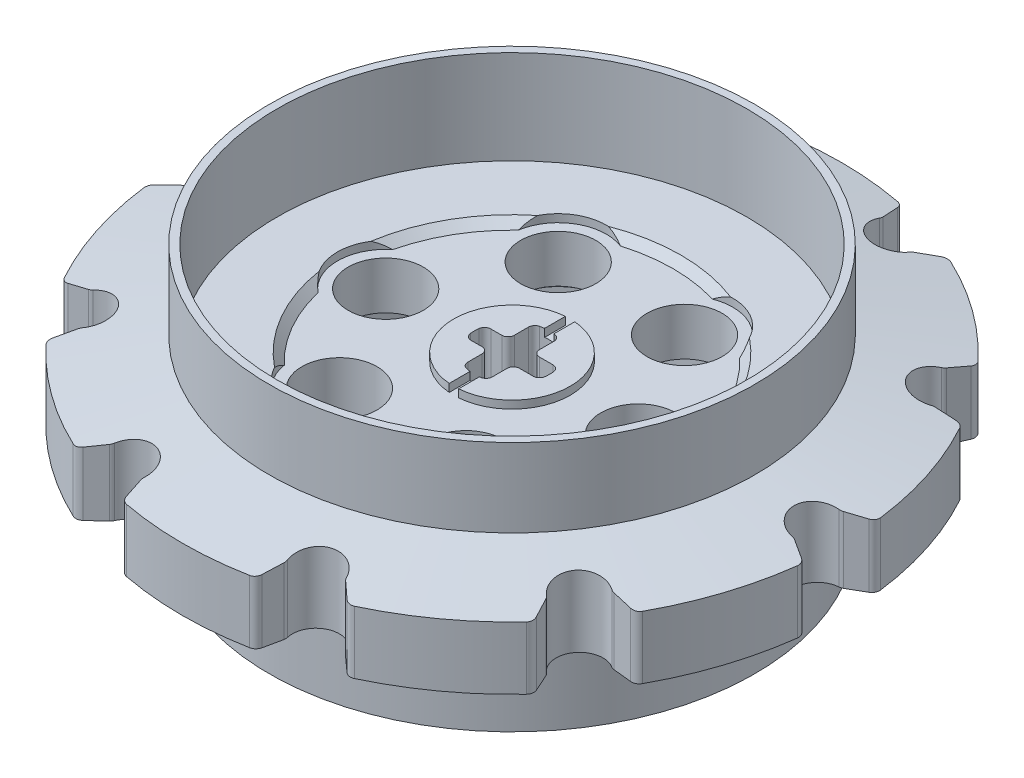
SolidWorks part; units mm, degrees
ref_plane "정면" through (0, 0, 0) normal (0, 0, 1) x (1, 0, 0)
ref_plane "윗면" through (0, 0, 0) normal (0, 1, 0) x (1, 0, 0)
ref_plane "우측면" through (0, 0, 0) normal (1, 0, 0) x (0, 0, -1)
imported_body "불러온 피처3"
sketch "스케치2" plane through (0, 1.5163, 0) normal (0, 1, 0) x (-1, 0, 0)
  line L0 (0.3, -3.7079) -> (0.3, 3.7079)
  arc A0 (0.3, 3.7079) -> (0.3, -3.7079) centre (0, 0) cw
extrude "보스-돌출1" add sketch "스케치2" along normal blind 0.5
sketch "스케치3" plane through (0, -1.5163, 0) normal (0, -1, 0) x (1, 0, 0)
  line L0 (-0.3, 3.7079) -> (-0.3, -3.7079)
  arc A0 (-0.3, -3.7079) -> (-0.3, 3.7079) centre (0, 0) cw
extrude "보스-돌출2" add sketch "스케치3" along normal blind 0.5
sketch "스케치6" plane through (0, 1.5163, 0) normal (0, 1, 0) x (-1, 0, 0)
  line L0 (-0.3, 3.7079) -> (-0.3, -3.7079)
  arc A0 (-0.3, -3.7079) -> (-0.3, 3.7079) centre (0, 0) cw
extrude "보스-돌출3" add sketch "스케치6" along normal blind 0.5
sketch "스케치7" plane through (0, -1.5163, 0) normal (0, -1, 0) x (1, 0, 0)
  line L0 (0.3, -3.7079) -> (0.3, 3.7079)
  arc A0 (0.3, 3.7079) -> (0.3, -3.7079) centre (0, 0) cw
extrude "보스-돌출4" add sketch "스케치7" along normal blind 0.5
hole_wizard "M4 여유 구멍1" positions "스케치12" profile "스케치11" hole size "M4" standard "Ansi Metric"
sketch "스케치12" plane through (0, 1.5163, 0) normal (0, 1, 0) x (1, 0, 0)
  point P0 (8.065, 0)
  point P1 (4.0325, 6.9845)
  point P2 (-4.0325, 6.9845)
  point P3 (-8.065, 0)
  point P4 (-4.0325, -6.9845)
  point P5 (4.0325, -6.9845)
sketch "스케치11" plane through (8.065, 1.5163, 0) normal (1, 0, 0) x (0, 0, 1)
  line L0 (0, 0) -> (0, 3.5325)
  line L1 (0, 3.5325) -> (2.4, 3.5325)
  line L2 (2.4, 3.5325) -> (2.4, 0)
  line L5 (2.4, 0) -> (0, 0)
  line L11 (0, -6.35) -> (0, 107.95) construction
  dimension "관통 구멍 지름" = 4.8
  dimension "관통 구멍 깊이" = 3.5325
sketch "스케치13" plane through (0, 0, 0) normal (0, 1, 0) x (1, 0, 0)
  line L0 (0.7155, 0.6311) -> (2.3155, 0.6311)
  line L1 (0.7155, -0.6311) -> (2.3155, -0.6311)
  line L2 (-0.8845, -2.2311) -> (-0.8845, -0.6311)
  line L3 (-0.8845, 0.6311) -> (-0.8845, 2.2311)
  line L4 (0.7155, -2.2909) -> (0.7155, -0.6311)
  line L5 (-2.3155, -0.6311) -> (-0.8845, -0.6311)
  line L6 (0.7155, 0.6311) -> (0.7155, 2.2909)
  line L7 (-2.3155, 0.6311) -> (-0.8845, 0.6311)
  arc A0 (-2.3155, 0.6311) -> (-2.3155, -0.6311) centre (0, 0) ccw
  arc A1 (0.7155, 2.2909) -> (-0.8845, 2.2311) centre (0, 0) ccw
  arc A2 (2.3155, -0.6311) -> (2.3155, 0.6311) centre (0, 0) ccw
  arc A3 (-0.8845, -2.2311) -> (0.7155, -2.2909) centre (0, 0) ccw
extrude "컷-돌출7" cut sketch "스케치13" against normal through all both and the other way through all
sketch "스케치14" plane through (0, 0, 0) normal (0, 0, 1) x (1, 0, 0)
  line L0 (0, -4.2769) -> (0, 5.1591) construction
  line L1 (21.05, 2) -> (15.5, 3)
  line L2 (15.5, 3) -> (15.5, 8)
  line L3 (20.55, -2) -> (20.55, 1.582)
  line L4 (15.5, 8) -> (15, 8)
  line L5 (21.05, -2) -> (21.05, 2)
  line L6 (15, 8) -> (15, 2.0162)
  line L7 (15, -8) -> (15.5, -8)
  line L8 (20.55, 1.582) -> (15.5, 2.4919)
  line L9 (15.5, -8) -> (15.5, 2.5)
  line L10 (20.55, -2) -> (21.05, -2)
  line L11 (11.785, 1.3) -> (11.785, 2.0162)
  line L12 (11.785, 2.0162) -> (15, 2.0162)
  line L13 (11.785, -1.3) -> (11.785, -2.0162)
  line L14 (11.785, -2.0162) -> (15, -2.0162)
  line L15 (15, -2.0162) -> (15, -8)
  line L16 (11.785, 2.0162) -> (-11.785, 2.0162) construction
  line L17 (20.55, 1.582) -> (15.4113, 2.5079) construction
  arc A0 (11.785, 1.3) -> (11.785, -1.3) centre (11.785, 0) ccw
  point P3 (18.275, 0)
  point P8 (15.5, 5.5)
  dimension "D10" = 1.3
  dimension "D1" = 21.05
  dimension "D2" = 4
  dimension "D3" = 0.5
  dimension "D4" = 15.5
  dimension "D5" = 0.5
  dimension "D6" = 16
  dimension "D8" = 15.5
  dimension "D9" = 1
  dimension "D11" = 11.785
  dimension "D7" = 0.5
revolve "회전1" add sketch "스케치14" angle 360 about L0
sketch "스케치15" plane through (0, 0, 0) normal (0, 1, 0) x (1, 0, 0)
  line L0 (19.5, 0) -> (23.7029, 0) construction
  line L1 (19.5, 1.5) -> (20.9217, 2.3208)
  line L2 (19.5, -1.5) -> (20.9217, -2.3208)
  arc A0 (19.5, 1.5) -> (19.5, -1.5) centre (19.5, 0) ccw
  circle A1 centre (0, 0) radius 21.05 construction
  dimension "D1" = 3
  dimension "D2" = 19.5
  dimension "D3" = 30
extrude "컷-돌출8" cut sketch "스케치15" against normal through all both and the other way through all
sketch "스케치16" plane through (0, 0, 0) normal (0, 1, 0) x (1, 0, 0)
  line L0 (19.5, 0) -> (2.8514, 0) construction
  line L1 (19.5, 1.5) -> (20.4887, 2.0708)
  line L2 (19.5, -1.5) -> (20.4887, -2.0708)
  arc A0 (19.5, 1.5) -> (19.5, -1.5) centre (19.5, 0) ccw
  arc A1 (19.5, 1.5) -> (19.5, -1.5) centre (19.5, 0) ccw construction
  dimension "D1" = 1.1416
extrude "돌출-얇게1" add sketch "스케치16" along normal up to surface and the other way up to surface thin
fillet "필렛3" radius 0.5 4 edges at (20.9217, 0, 2.3208) (20.9217, 0, -2.3208) (19.5, 0.1344, -1.5) (19.5, 0.1344, 1.5)
pattern_circular "원형 패턴1" count 10 over 360 about axis through (0, 0, 0) along (0, 1, 0) of "컷-돌출8", "돌출-얇게1", "필렛3"
fillet "필렛4" radius 0.4 12 edges at (2.3155, 0, -0.6311) (2.3155, 0, 0.6311) (0.7155, 0, 0.6311) (0.7155, 0, 2.2909) (-0.8845, 0, 2.2311) (-0.8845, 0, 0.6311) (-2.3155, 0, 0.6311) (-2.3155, 0, -0.6311) (-0.8845, 0, -0.6311) (-0.8845, 0, -2.2311) (0.7155, 0, -2.2909) (0.7155, 0, -0.6311)
